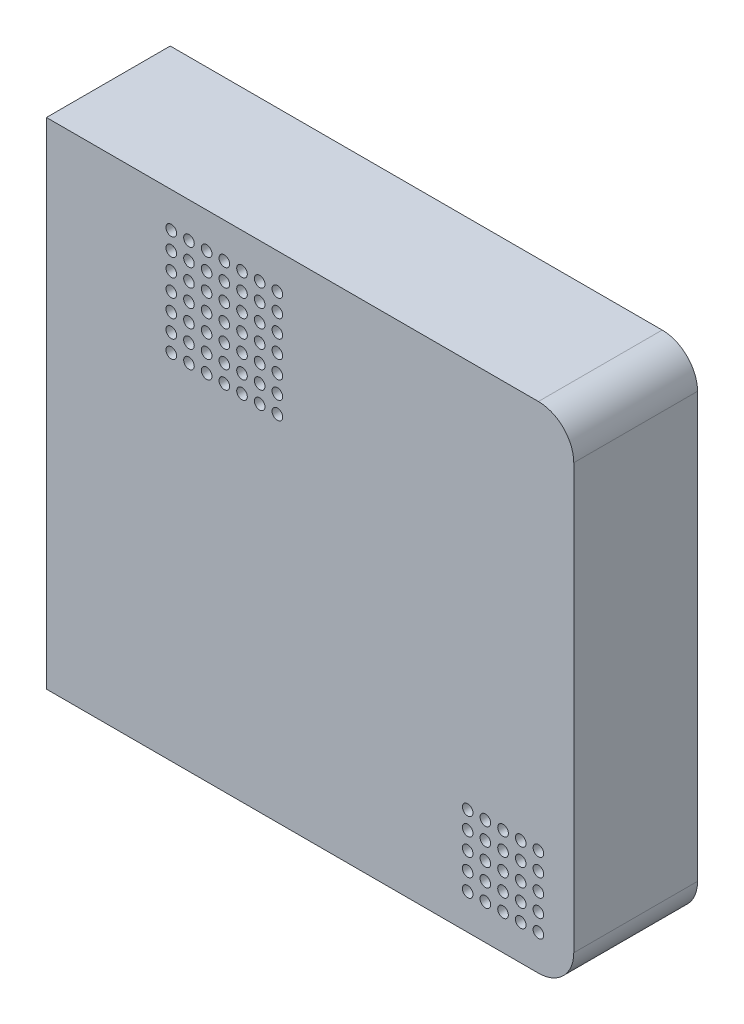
SolidWorks part; units mm, degrees
ref_plane "Front Plane" through (0, 0, 0) normal (0, 0, 1) x (1, 0, 0)
ref_plane "Top Plane" through (0, 0, 0) normal (0, 1, 0) x (1, 0, 0)
ref_plane "Right Plane" through (0, 0, 0) normal (1, 0, 0) x (0, 0, -1)
body saved out of another part "Stock-Top2-1"
other "Lip&Groove2-Groove" parameters "GrooveHeight"=2.032, "GrooveWidth"=2, "GrooveDraftAngle"=3, "Clearance"=0, "Gap"=0, "upGap"=2.032, "D7"=2, "D8"=3, "D9"=0
fillet "Fillet1" radius 2 12 edges at (-17, 66, 23.5) (-22, 66, 23.5) (48, 66, 23.5) (43, 66, 23.5) (84, -34, 28) (87, -37, 28) (-25.1078, -66, 16.516) (-25.1078, 66, 16.516) (-22, -66, 23.5) (-17, -66, 23.5) (43, -66, 23.5) (48, -66, 23.5)
